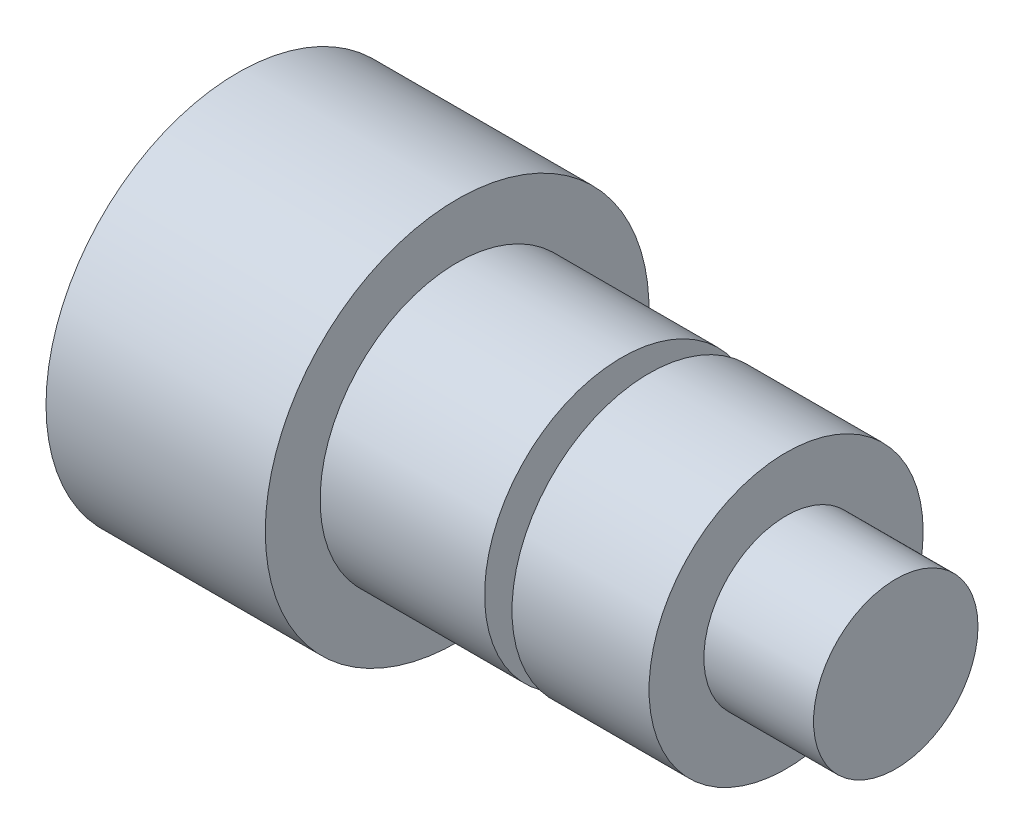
SolidWorks part; units mm, degrees
ref_plane "Plane1" through (0, 0, 0) normal (0, 0, 1) x (1, 0, 0)
ref_plane "Plane2" through (0, 0, 0) normal (0, 1, 0) x (1, 0, 0)
ref_plane "Plane3" through (0, 0, 0) normal (1, 0, 0) x (0, 0, -1)
sketch "Sketch1" plane through (0, 0, 0) normal (1, 0, 0) x (0, 0, -1)
  circle A0 centre (0, 0) radius 44.45
  dimension "D1" = 88.9
extrude "Base-Extrude" add sketch "Sketch1" along normal blind 152.4
sketch "Sketch2" plane through (0, 0, 0) normal (0, 0, 1) x (1, 0, 0)
  line L0 (50.8, 64.2079) -> (186.8896, 64.2079)
  line L1 (50.8, 64.2079) -> (50.8, 31.75)
  line L2 (186.8896, 31.75) -> (50.8, 31.75)
  line L3 (186.8896, 31.75) -> (186.8896, 64.2079)
  line L4 (0, 44.45) -> (0, -44.45) construction
  line L5 (0, 0) -> (-8.6008, 0) construction
  line L6 (152.4, 0) -> (0, 0) construction
  line L8 (152.4, -44.45) -> (152.4, 44.45) construction
  dimension "D1" = 50.8
  dimension "D2" = 63.5
revolve "Cut-Revolve1" cut sketch "Sketch2" angle 360 about L5
sketch "Sketch3" plane through (0, 0, 0) normal (0, 0, 1) x (1, 0, 0)
  line L0 (88.9, 22.225) -> (88.9, 68.5409)
  line L1 (0, 0) -> (-21.4905, 0) construction
  line L2 (50.8, 0) -> (0, 0) construction
  line L3 (0, 44.45) -> (0, -44.45) construction
  line L4 (152.4, 31.75) -> (50.8, 31.75) construction
  dimension "D1" = 88.9
  dimension "D2" = 9.525
other "Cut-Revolve-Thin1" parameters "D1"=360, "D3"=6.35, "D4"=25.4, "D7"=0
sketch "Sketch4" plane through (0, 0, 0) normal (0, 0, 1) x (1, 0, 0)
  line L0 (127, 19.05) -> (164.0278, 19.05)
  line L1 (127, 19.05) -> (127, 53.1783)
  line L2 (164.0278, 53.1783) -> (127, 53.1783)
  line L3 (164.0278, 53.1783) -> (164.0278, 19.05)
  line L4 (152.4, -31.75) -> (152.4, 31.75) construction
  line L5 (0, 0) -> (-13.6122, 0) construction
  line L6 (50.8, 0) -> (0, 0) construction
  dimension "D1" = 25.4
  dimension "D2" = 38.1
revolve "Cut-Revolve2" cut sketch "Sketch4" angle 360 about L5
